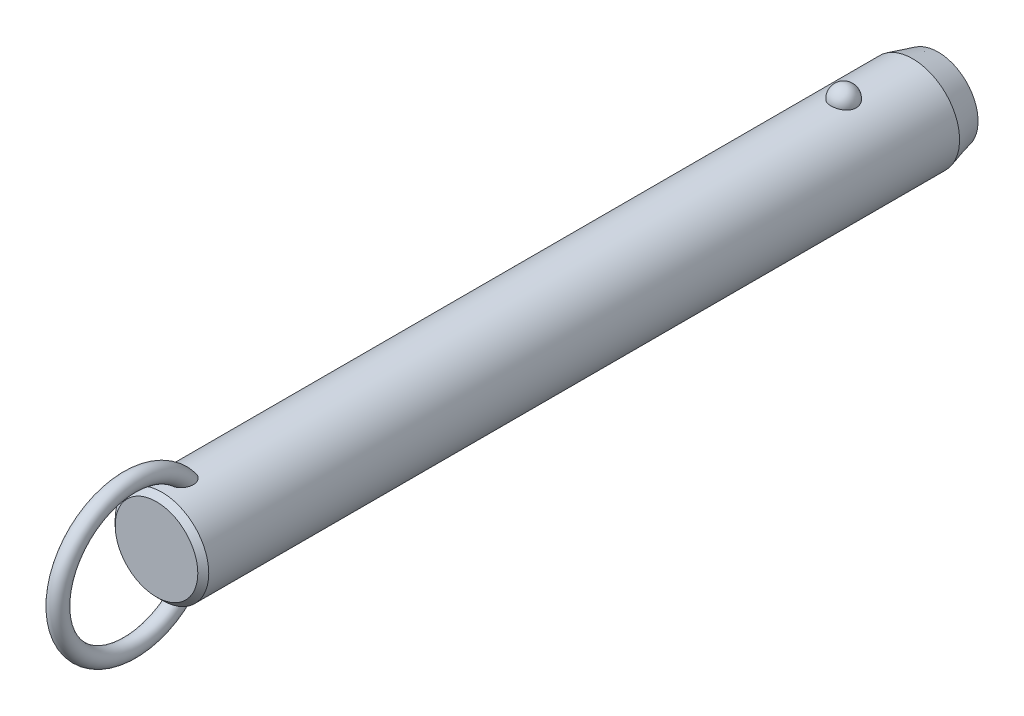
SolidWorks part; units mm, degrees
ref_plane "Front Plane" through (0, 0, 0) normal (0, 0, 1) x (1, 0, 0)
ref_plane "Top Plane" through (0, 0, 0) normal (0, 1, 0) x (1, 0, 0)
ref_plane "Right Plane" through (0, 0, 0) normal (1, 0, 0) x (0, 0, -1)
sketch "Sketch2" plane through (0, 0, 0) normal (0, 0, 1) x (1, 0, 0)
  circle A0 centre (0, 0) radius 11.1
  point P3 (0, 11.1)
  dimension "D1" = 22.2
extrude "Boss-Extrude1" add sketch "Sketch2" along normal blind 147.3
sketch "Sketch3" plane through (0, 0, 0) normal (0, 0, -1) x (-1, 0, 0)
  circle A0 centre (0, 0) radius 11.1
  dimension "D1" = 22.2
extrude "Boss-Extrude2" add sketch "Sketch3" along normal blind 25.4
chamfer "Chamfer1" distance 6 angle 15 1 edges at (-11.1, 0, -25.4)
sketch "Sketch12" plane through (0, 0, 0) normal (1, 0, 0) x (0, 0, -1)
  line L0 (-147.3, 11.1) -> (-147.3, -11.1) construction
  point P0 (-147.3, 0)
sketch "Sketch13" plane through (0, 0, 0) normal (1, 0, 0) x (0, 0, -1)
  circle A0 centre (-166.35, 0) radius 19.05
  point P2 (-147.3, 0)
  dimension "D1" = 38.1
sketch "Sketch14" plane through (0, 0, 0) normal (0, 1, 0) x (1, 0, 0)
  circle A0 centre (0, -149.3) radius 2
  point P2 (0, -147.3)
  dimension "D1" = 4
sweep "Sweep1" add profiles "Sketch14" path "Sketch13"
sketch "Sketch15" plane through (0, 0, 147.3) normal (0, 0, 1) x (1, 0, 0)
  circle A0 centre (0, 0) radius 11.1
  dimension "D1" = 22.2
extrude "Boss-Extrude3" add sketch "Sketch15" along normal blind 12.7
chamfer "Chamfer2" distance 1.3 angle 45 1 edges at (11.1, 0, 160)
sketch "Sketch18" plane through (0, 0, 0) normal (1, 0, 0) x (0, 0, -1)
  line L0 (19.4, 11.1) -> (-150.868, 11.1) construction
  line L1 (3, 14.1) -> (3, 8.1)
  line L2 (-150.868, -11.1) -> (19.4, -11.1) construction
  arc A0 (3, 14.1) -> (3, 8.1) centre (3, 11.1) ccw
  point P4 (0, 11.1)
  dimension "D1" = 25.2
revolve "Revolve1" add sketch "Sketch18" angle 360 about L1
